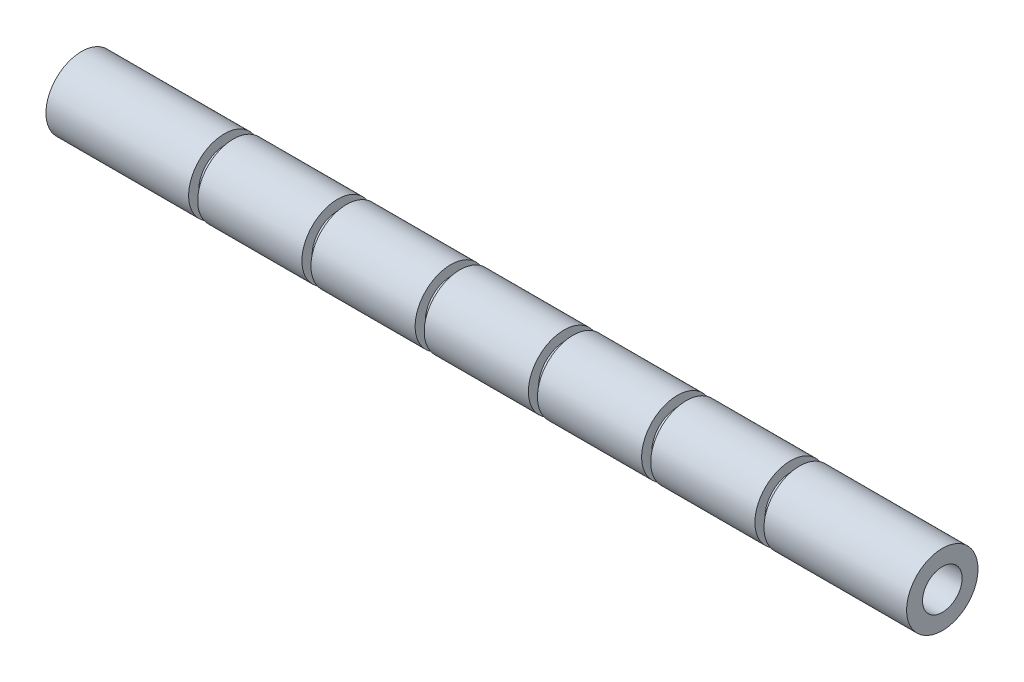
SolidWorks part; units mm, degrees
ref_plane "Plan de face" through (0, 0, 0) normal (0, 0, 1) x (1, 0, 0)
ref_plane "Plan de dessus" through (0, 0, 0) normal (0, 1, 0) x (1, 0, 0)
ref_plane "Plan de droite" through (0, 0, 0) normal (1, 0, 0) x (0, 0, -1)
sketch "Esquisse1" plane through (0, 0, 0) normal (1, 0, 0) x (0, 0, -1)
  circle A0 centre (0, 0) radius 17.5
  circle A1 centre (0, 0) radius 31.5
  dimension "D1" = 35
  dimension "D2" = 63
extrude "Extrusion1" add sketch "Esquisse1" along normal mid plane 760
sketch "Esquisse2" plane through (0, 0, 0) normal (0, 0, 1) x (1, 0, 0)
  line L0 (0, 0) -> (-482.2679, 0) construction
  line L1 (-254, 31.5) -> (-246, 31.5)
  line L2 (-254, 31.5) -> (-254, 22.5)
  line L3 (-254, 22.5) -> (-246, 22.5)
  line L4 (-246, 31.5) -> (-246, 22.5)
  line L5 (-380, 31.5) -> (-380, -31.5) construction
  line L6 (380, 31.5) -> (-380, 31.5) construction
  dimension "D1" = 45
  dimension "D2" = 8
  dimension "D3" = 126
revolve "Enlèvement de matière-Révolution1" cut sketch "Esquisse2" angle 360 about L0
pattern_linear "Répétition linéaire1" count 6 spacing 100 along (1, 0, 0) of "Enlèvement de matière-Révolution1"
